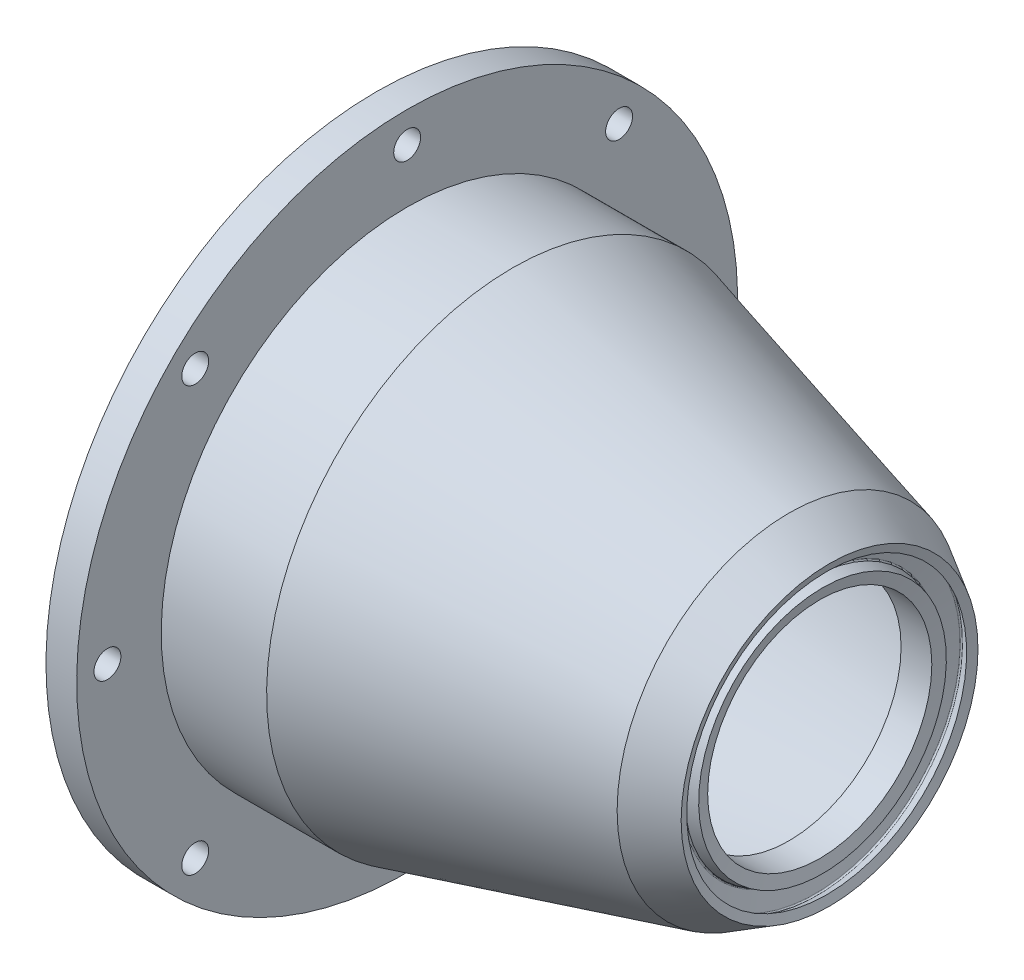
SolidWorks part; units mm, degrees
ref_plane "Front" through (0, 0, 0) normal (0, 0, 1) x (1, 0, 0)
ref_plane "Top" through (0, 0, 0) normal (0, 1, 0) x (1, 0, 0)
ref_plane "Right" through (0, 0, 0) normal (1, 0, 0) x (0, 0, -1)
sketch "Sketch1" plane through (0, 0, 0) normal (0, 0, 1) x (1, 0, 0)
  line L0 (0, 0) -> (-190.5, 0) construction
  line L1 (-190.5, 68.2625) -> (-190.5, -68.2625) construction
  line L2 (-190.5, 68.2625) -> (-184.15, 68.2625)
  line L3 (-184.15, 68.2625) -> (-184.15, 50.8)
  line L4 (-192.8876, 47.625) -> (-162.8, 47.625)
  line L5 (-184.15, 50.8) -> (-162.382, 50.8)
  line L6 (-162.382, 50.8) -> (-105.2801, 35.4996)
  line L7 (-96.8962, 30.6592) -> (-97.4973, 28.9111)
  line L8 (-122.994, 5.7325) -> (-101.6, 0) construction
  line L9 (0, 0) -> (-253.8905, 105.1649) construction
  line L10 (-162.8, 47.625) -> (-105.2769, 32.2118)
  line L11 (-192.8876, 50.927) -> (-190.5, 50.927)
  line L12 (-190.5, 68.2625) -> (-190.5, 55.6117)
  line L13 (-98.9269, 23.1521) -> (-105.2769, 23.1521)
  line L14 (-105.2769, 23.1521) -> (-105.2769, 32.2118)
  line L15 (-192.8876, 50.927) -> (-192.8876, 47.625)
  line L16 (0, 0) -> (-100.6431, 26.9672) construction
  line L17 (-97.4973, 28.9111) -> (-99.4839, 30.058)
  line L18 (-99.8562, 29.9038) -> (-100.7698, 26.4943)
  line L19 (-100.5902, 26.1832) -> (-98.3576, 25.585)
  line L20 (-98.3576, 25.585) -> (-98.9269, 23.1521)
  line L21 (-190.5, 55.6117) -> (-188.2543, 56.2134)
  line L22 (-190.5, 50.927) -> (-190.5, 52.1843)
  line L23 (-190.5, 52.1843) -> (-188.1886, 52.1843)
  line L24 (-187.9346, 55.9681) -> (-187.9346, 52.4383)
  line L25 (-105.2801, 35.4996) -> (-96.8962, 30.6592)
  circle A0 centre (-98.6735, 27.4972) radius 1.7653 construction
  circle A1 centre (0, 0) radius 101.6 construction
  arc A2 (-99.4839, 30.058) -> (-99.8562, 29.9038) centre (-99.6109, 29.8381) ccw
  arc A3 (-100.7698, 26.4943) -> (-100.5902, 26.1832) centre (-100.5245, 26.4286) ccw
  arc A4 (-188.2543, 56.2134) -> (-187.9346, 55.9681) centre (-188.1886, 55.9681) cw
  arc A5 (-188.1886, 52.1843) -> (-187.9346, 52.4383) centre (-188.1886, 52.4383) ccw
  point P10 (-96.0796, 33.0343)
  point P22 (-99.7706, 30.2236)
  point P36 (-100.8356, 26.249)
  point P39 (-187.9346, 56.2991)
  point P42 (-187.9346, 52.1843)
  dimension "D21" = 203.2
  dimension "D26" = 3.5306
  dimension "D27" = 0.254
  dimension "D28" = 0.254
  dimension "D1" = 190.5
  dimension "D3" = 46.3042
  dimension "D4" = 15
  dimension "D5" = 3.175
  dimension "D6" = 2.3876
  dimension "D7" = 2.5654
  dimension "D8" = 66.675
  dimension "D9" = 101.6
  dimension "D10" = 101.854
  dimension "D11" = 22.5
  dimension "D12" = 104.3686
  dimension "D13" = 136.525
  dimension "D14" = 3.175
  dimension "D15" = 6.35
  dimension "D16" = 9.525
  dimension "D17" = 6.35
  dimension "D18" = 4.1148
  dimension "D19" = 2.5654
  dimension "D20" = 51.1048
  dimension "D22" = 4.1148
  dimension "D23" = 6.2483
  dimension "D24" = 75
  dimension "D25" = 75
  dimension "D29" = 15
revolve "Revolve3" add sketch "Sketch1" angle 360 about L0
hole_wizard "7/32 (0.21875) Diameter Hole1" positions "Sketch3" profile "Sketch2" hole size "7/32" standard "Ansi Inch"
sketch "Sketch3" plane through (-190.5, 0, 0) normal (-1, 0, 0) x (0, 0, 1)
  point P0 (61.9125, 0)
  point P1 (43.7787, 43.7787)
  point P4 (0, 61.9125)
  point P7 (43.7787, -43.7787)
  point P10 (0, -61.9125)
  point P12 (-43.7787, 43.7787)
  point P15 (-61.9125, 0)
  point P18 (-43.7787, -43.7787)
sketch "Sketch2" plane through (-190.5, 0, 61.9125) normal (0, 1, 0) x (0, 0, 1)
  line L0 (0, 0) -> (0, 93.6038)
  line L1 (0, 93.6038) -> (2.7781, 93.6038)
  line L2 (2.7781, 93.6038) -> (2.7781, 0)
  line L5 (2.7781, 0) -> (0, 0)
  line L11 (0, -6.35) -> (0, 107.95) construction
  dimension "Thru Hole Dia." = 5.5562
  dimension "Thru Hole Depth" = 93.6038
sketch "Sketch4" plane through (-184.15, 0, 0) normal (1, 0, 0) x (0, 0, -1)
  circle A0 centre (-43.7787, 43.7787) radius 3.9687
  circle A1 centre (0, 0) radius 68.2625 construction
  dimension "D1" = 7.9375
  dimension "D2" = 3.175
equation "\"D14@Sketch1\" = \"D5@Sketch1\""
